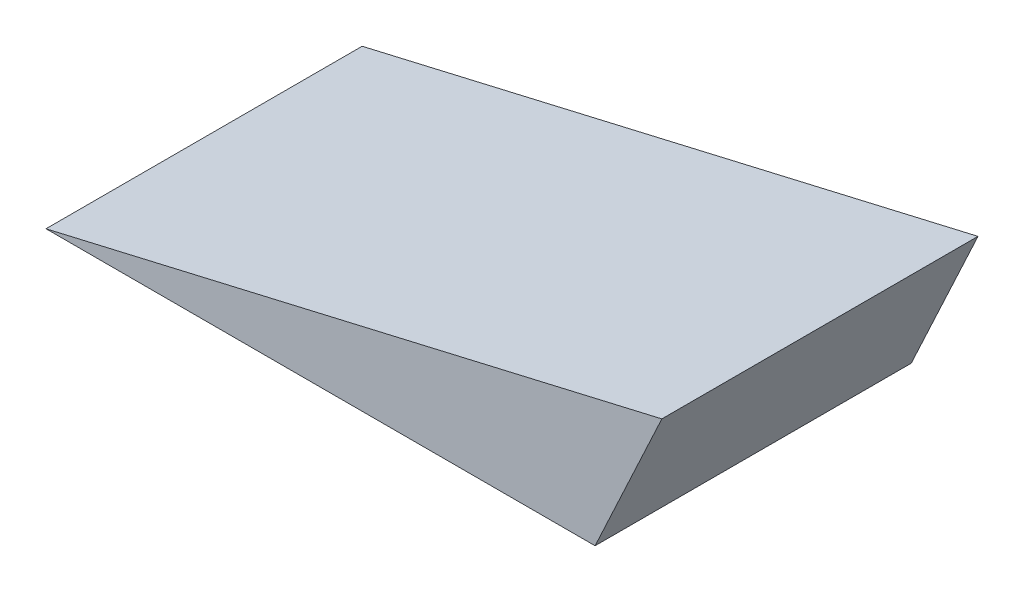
SolidWorks part; units mm, degrees
ref_plane "Front Plane" through (0, 0, 0) normal (0, 0, 1) x (1, 0, 0)
ref_plane "Top Plane" through (0, 0, 0) normal (0, 1, 0) x (1, 0, 0)
ref_plane "Right Plane" through (0, 0, 0) normal (1, 0, 0) x (0, 0, -1)
sketch "Sketch3" plane through (0, 0, 0) normal (0, 0, 1) x (1, 0, 0)
  line L0 (0, 0) -> (-34.7358, 0)
  line L1 (-34.7358, 0) -> (4.2236, 9.0643)
  line L2 (4.2236, 9.0643) -> (0, 0)
  point P3 (0.4007, 0)
extrude "Boss-Extrude1" add sketch "Sketch3" along normal blind 20
equation "\"A\"= 10"
equation "\"B\" = 40'9"
equation "\"C\" = 20"
equation "\"D1@Sketch3\"=\"A\""
equation "\"D2@Sketch3\"=\"B\""
equation "\"D1@Boss-Extrude1\"=\"C\""
